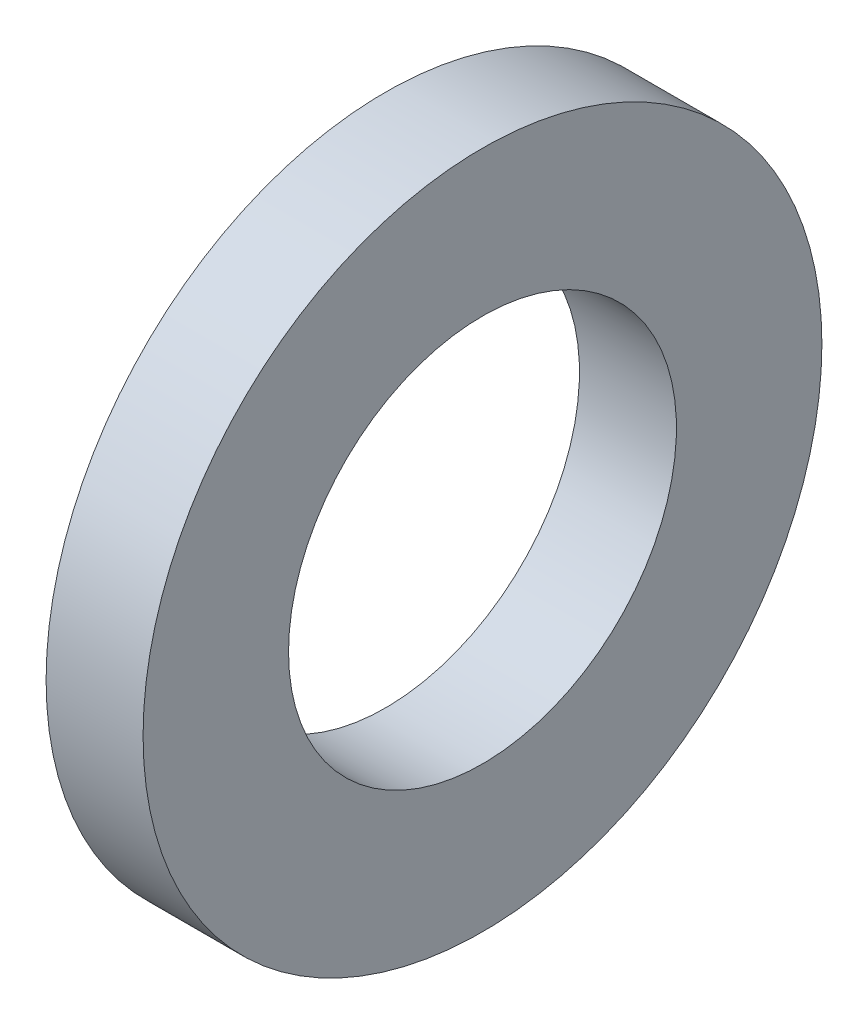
SolidWorks part; units mm, degrees
ref_plane "Plan1" through (0, 0, 0) normal (0, 0, 1) x (1, 0, 0)
ref_plane "Plan2" through (0, 0, 0) normal (0, 1, 0) x (1, 0, 0)
ref_plane "Plan3" through (0, 0, 0) normal (1, 0, 0) x (0, 0, -1)
sketch "Esquisse1" plane through (0, 0, 0) normal (0, 0, 1) x (1, 0, 0)
  line L0 (0, 4) -> (0, 7)
  line L4 (2, 7) -> (2, 4)
  line L8 (-12.5747, 0) -> (48.4041, 0) construction
  line L9 (0, 7) -> (2, 7)
  line L10 (2, 4) -> (0, 4)
  dimension "D1" = 2
  dimension "D2" = 7
  dimension "D3" = 4
revolve "Base-Révolution" add sketch "Esquisse1" angle 360 about L8
